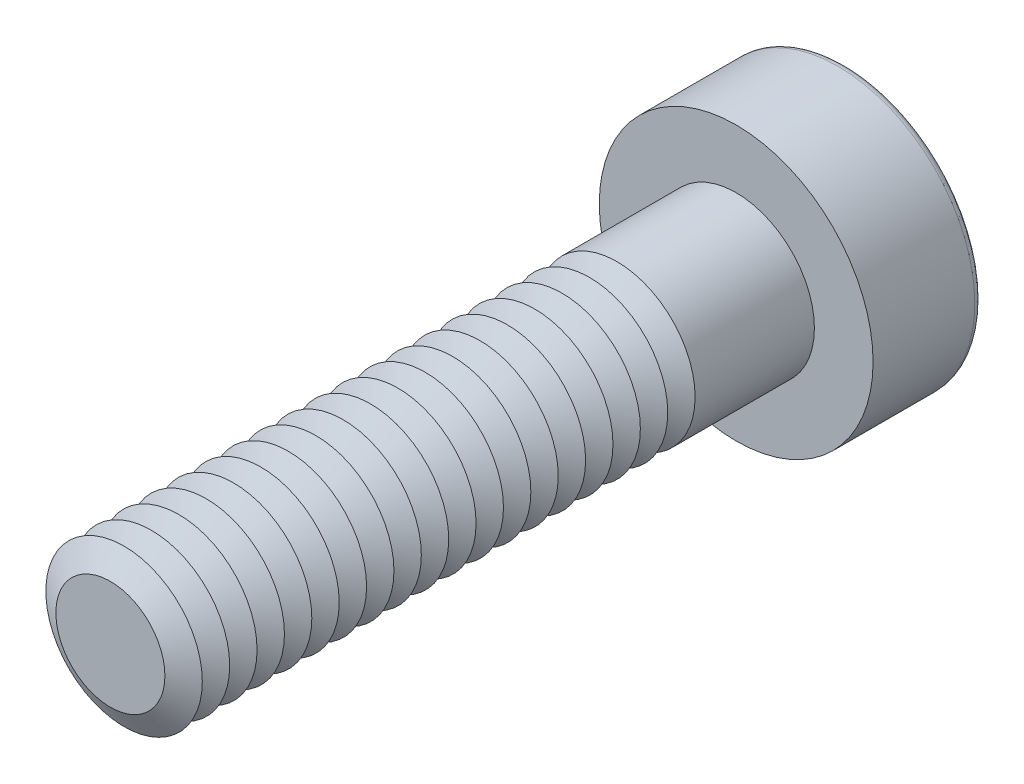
SolidWorks part; units mm, degrees
ref_plane "Front Plane" through (0, 0, 0) normal (0, 0, 1) x (1, 0, 0)
ref_plane "Top Plane" through (0, 0, 0) normal (0, 1, 0) x (1, 0, 0)
ref_plane "Right Plane" through (0, 0, 0) normal (1, 0, 0) x (0, 0, -1)
sketch "Sketch1" plane through (0, 0, 0) normal (0, 0, 1) x (1, 0, 0)
  circle A0 centre (0, 0) radius 2
  dimension "D1" = 4
extrude "Boss-Extrude1" add sketch "Sketch1" along normal blind 16
sketch "Sketch2" plane through (0, 0, 0) normal (0, 0, -1) x (-1, 0, 0)
  circle A0 centre (0, 0) radius 3.5
  dimension "D1" = 7
extrude "Boss-Extrude2" add sketch "Sketch2" along normal blind 2.8
sketch "Sketch3" plane through (0, 0, -2.8) normal (0, 0, -1) x (-1, 0, 0)
  line L1 (-0.7217, 1.25) -> (-1.4434, 0)
  line L2 (-1.4434, 0) -> (-0.7217, -1.25)
  line L3 (-0.7217, -1.25) -> (0.7217, -1.25)
  line L4 (0.7217, -1.25) -> (1.4434, 0)
  line L5 (1.4434, 0) -> (0.7217, 1.25)
  line L6 (0.7217, 1.25) -> (-0.7217, 1.25)
  circle A0 centre (0, 0) radius 1.25 construction
  dimension "D1" = 2.5
extrude "Cut-Extrude1" cut sketch "Sketch3" against normal blind 1.875
fillet "Fillet1" radius 0.2 1 edges at (-3.5, 0, -2.8)
sketch "Sketch4" plane through (0, 0, -0.925) normal (0, 0, -1) x (-1, 0, 0)
  line L0 (0.7217, -1.25) -> (1.4434, 0) construction
  circle A0 centre (0, 0) radius 1.25
extrude "Cut-Extrude2" cut sketch "Sketch4" against normal through all draft 60
sketch "Sketch5" plane through (0, 0, -2.8) normal (0, 0, -1) x (-1, 0, 0)
  circle A0 centre (0, 0) radius 1.4434
extrude "Cut-Extrude3" cut sketch "Sketch5" against normal through all draft 75
sketch "Sketch7" plane through (0, 0, 0) normal (1, 0, 0) x (0, 0, -1)
  line L25 (-16, 1.3938) -> (-15.65, 2)
  line L26 (-16, 2) -> (-16, -2) construction
  line L27 (-15.65, 2) -> (-16.35, 2)
  line L28 (-16.35, 2) -> (-16, 1.3938)
  line L29 (0, 2) -> (-16, 2) construction
  dimension "D1" = 0.7
revolve "Cut-Revolve1" cut sketch "Sketch7" angle 360 about axis through (0, 0, 16) along (0, 0, -1)
pattern_linear "LPattern1" count 19 spacing 0.7 along (0, 0, -1) of "Cut-Revolve1"
